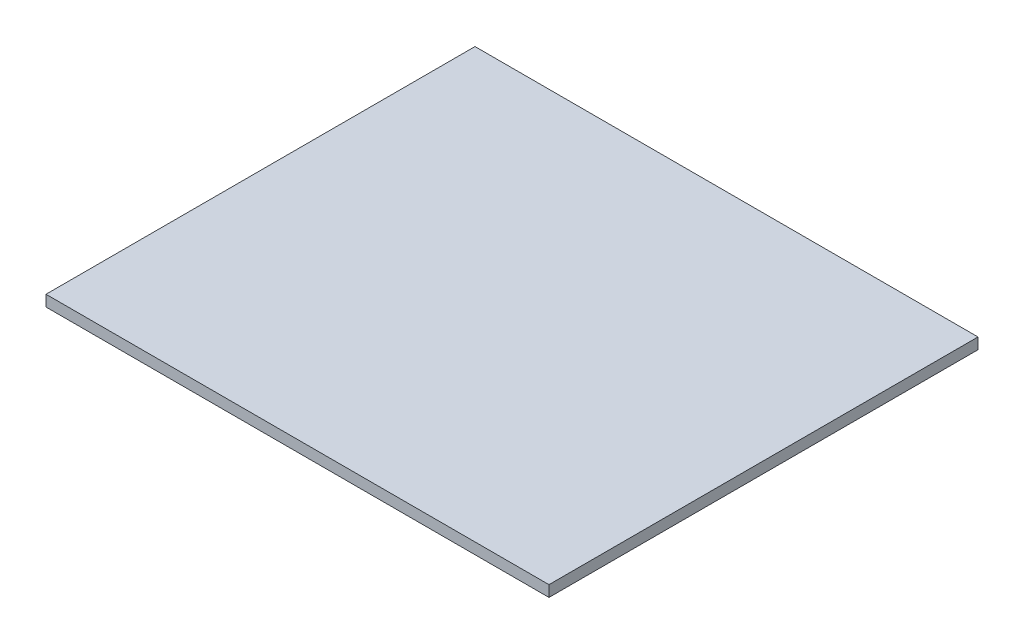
SolidWorks part; units mm, degrees
ref_plane "Front Plane" through (0, 0, 0) normal (0, 0, 1) x (1, 0, 0)
ref_plane "Top Plane" through (0, 0, 0) normal (0, 1, 0) x (1, 0, 0)
ref_plane "Right Plane" through (0, 0, 0) normal (1, 0, 0) x (0, 0, -1)
sketch "Sketch1" plane through (0, 0, 0) normal (0, 1, 0) x (1, 0, 0)
  line L1 (-107.95, -92.075) -> (107.95, -92.075)
  line L2 (-107.95, -92.075) -> (-107.95, 92.075)
  line L3 (-107.95, 92.075) -> (107.95, 92.075)
  line L4 (107.95, -92.075) -> (107.95, 92.075)
  line L5 (-107.95, -92.075) -> (107.95, 92.075) construction
  line L6 (-107.95, 92.075) -> (107.95, -92.075) construction
  point P0 (0, 0)
  dimension "D1" = 215.9
  dimension "D2" = 184.15
extrude "Boss-Extrude1" add sketch "Sketch1" along normal blind 4.7625
